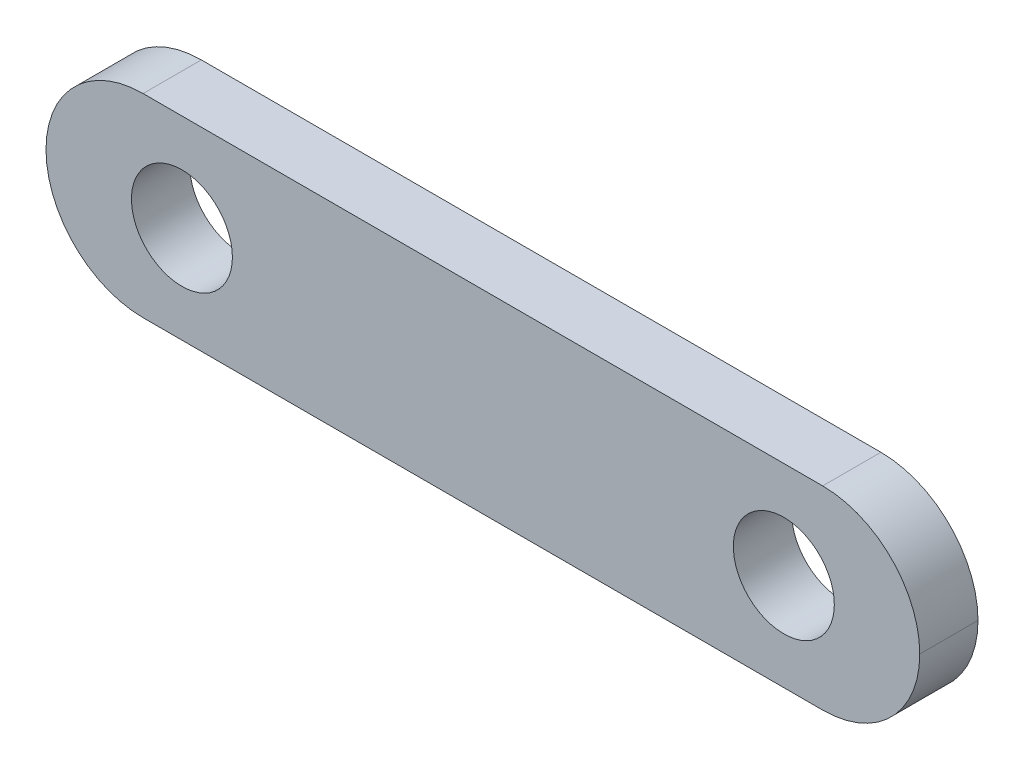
SolidWorks part; units mm, degrees
ref_plane "Plan de face" through (0, 0, 0) normal (0, 0, 1) x (1, 0, 0)
ref_plane "Plan de dessus" through (0, 0, 0) normal (0, 1, 0) x (1, 0, 0)
ref_plane "Plan de droite" through (0, 0, 0) normal (1, 0, 0) x (0, 0, -1)
sketch "Esquisse1" plane through (0, 0, 0) normal (0, 0, 1) x (1, 0, 0)
  line L1 (-47.7033, 11.0231) -> (-2.7033, 11.0231)
  line L2 (-47.7033, 11.0231) -> (-47.7033, 1.0231)
  line L3 (-47.7033, 1.0231) -> (-2.7033, 1.0231)
  line L4 (-2.7033, 11.0231) -> (-2.7033, 1.0231)
  dimension "D1" = 45
  dimension "D2" = 10
extrude "Extrusion1" add sketch "Esquisse1" along normal blind 3
sketch "Esquisse2" plane through (0, 0, 3) normal (0, 0, 1) x (1, 0, 0)
  line L0 (-2.7033, 11.0231) -> (-47.7033, 11.0231) construction
  line L1 (-47.7033, 11.0231) -> (-47.7033, 1.0231) construction
  circle A0 centre (-40.7033, 6.0231) radius 2.6
  circle A1 centre (-9.7033, 6.0231) radius 2.6
  dimension "D1" = 5.2
  dimension "D2" = 5
  dimension "D3" = 7
  dimension "D4" = 31
  dimension "D5" = 5.2
extrude "Enlèv. mat.-Extru.1" cut sketch "Esquisse2" against normal blind 3
fillet "Congé1" radius 5 8 edges at (-2.7033, 6.0231, 3) (-47.7033, 6.0231, 3) (-2.7033, 6.0231, 0) (-47.7033, 6.0231, 0) (-47.7033, 11.0231, 1.5) (-2.7033, 11.0231, 1.5) (-2.7033, 1.0231, 1.5) (-47.7033, 1.0231, 1.5)
